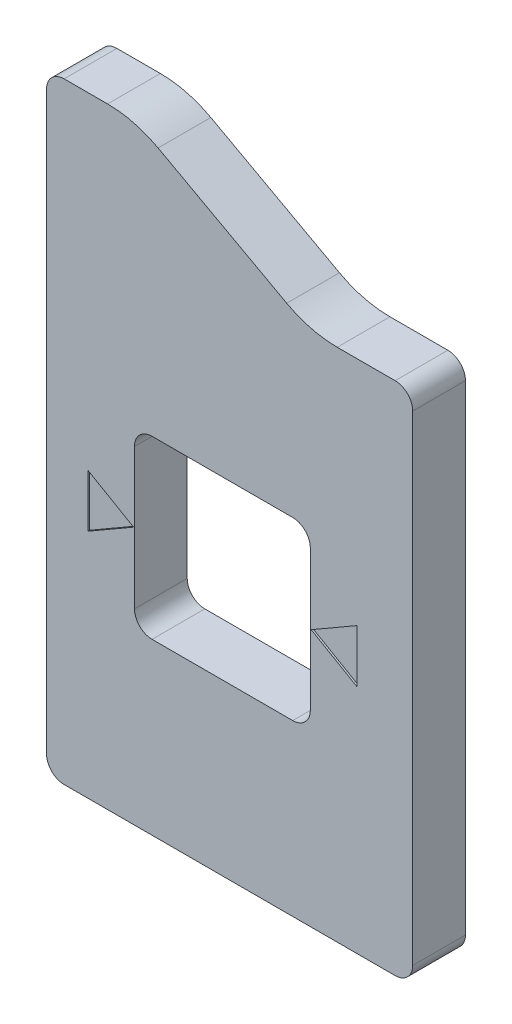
SolidWorks part; units mm, degrees
ref_plane "Plan de face" through (0, 0, 0) normal (0, 0, 1) x (1, 0, 0)
ref_plane "Plan de dessus" through (0, 0, 0) normal (0, 1, 0) x (1, 0, 0)
ref_plane "Plan de droite" through (0, 0, 0) normal (1, 0, 0) x (0, 0, -1)
sketch "Esquisse1" plane through (0, 0, 3) normal (0, 0, 1) x (1, 0, 0)
  line L0 (15.8224, -41.6651) -> (15.8224, -14.3635) construction
  line L1 (14.8224, -13.3635) -> (10, -13.3635) construction
  line L4 (0, -7.9099) -> (-4, -7.9099) construction
  line L5 (-5, -8.9099) -> (-5, -41.6651) construction
  line L8 (15.8224, -41.6651) -> (15.8224, -14.3635)
  line L9 (14.8224, -13.3635) -> (11.5297, -13.3635)
  line L12 (-1.5297, -7.9099) -> (-4, -7.9099)
  line L13 (-5, -8.9099) -> (-5, -41.6651)
  line L16 (-4, -42.6651) -> (14.8224, -42.6651)
  line L17 (1.343, -8.6423) -> (8.657, -12.6311)
  line L18 (1, -23.0143) -> (9, -23.0143)
  line L19 (0, -24.0143) -> (0, -32.0143)
  line L20 (1, -33.0143) -> (9, -33.0143)
  line L21 (10, -24.0143) -> (10, -32.0143)
  line L22 (0, -7.9099) -> (0, -28.0143) construction
  line L23 (10, -42.6651) -> (10, -13.3635) construction
  line L24 (15.8224, -28.0143) -> (-5, -28.0143) construction
  arc A0 (15.8224, -14.3635) -> (14.8224, -13.3635) centre (14.8224, -14.3635) ccw construction
  arc A1 (14.8224, -42.6651) -> (15.8224, -41.6651) centre (14.8224, -41.6651) ccw construction
  arc A2 (-4, -7.9099) -> (-5, -8.9099) centre (-4, -8.9099) ccw construction
  arc A3 (-5, -41.6651) -> (-4, -42.6651) centre (-4, -41.6651) ccw construction
  arc A4 (15.8224, -14.3635) -> (14.8224, -13.3635) centre (14.8224, -14.3635) ccw
  arc A5 (14.8224, -42.6651) -> (15.8224, -41.6651) centre (14.8224, -41.6651) ccw
  arc A6 (-4, -7.9099) -> (-5, -8.9099) centre (-4, -8.9099) ccw
  arc A7 (-5, -41.6651) -> (-4, -42.6651) centre (-4, -41.6651) ccw
  arc A8 (11.5297, -13.3635) -> (8.657, -12.6311) centre (11.5297, -7.3635) cw
  arc A9 (-1.5297, -7.9099) -> (1.343, -8.6423) centre (-1.5297, -13.9099) cw
  arc A10 (0, -32.0143) -> (1, -33.0143) centre (1, -32.0143) ccw
  arc A11 (9, -33.0143) -> (10, -32.0143) centre (9, -32.0143) ccw
  arc A12 (9, -23.0143) -> (10, -24.0143) centre (9, -24.0143) cw
  arc A13 (1, -23.0143) -> (0, -24.0143) centre (1, -24.0143) ccw
  point P24 (0, -28.0143)
  point P37 (10, -23.0143)
  point P40 (0, -23.0143)
  dimension "D1" = 6
  dimension "D3" = 1
  dimension "D2" = 10
extrude "Boss.-Extru.1" add sketch "Esquisse1" along normal blind 3
sketch "Esquisse2" plane through (0, 0, 6) normal (0, 0, 1) x (1, 0, 0)
  line L1 (-2.6481, -26.5143) -> (-2.6481, -29.5143)
  line L4 (-0.05, -28.0143) -> (10.05, -28.0143) construction
  line L5 (-0.05, -28.0143) -> (-2.6481, -26.5143)
  line L6 (10.05, -28.0143) -> (5, -23.0143) construction
  line L7 (9, -23.0143) -> (1, -23.0143) construction
  line L8 (5, -23.0143) -> (5, -33.0143) construction
  line L9 (1, -33.0143) -> (9, -33.0143) construction
  line L10 (10.05, -28.0143) -> (12.6481, -26.5143)
  line L11 (12.6481, -26.5143) -> (12.6481, -29.5143)
  line L12 (12.6481, -29.5143) -> (10.05, -28.0143)
  line L13 (10, -32.0143) -> (10, -24.0143) construction
  line L14 (-2.6481, -29.5143) -> (-0.05, -28.0143)
  point P1 (0, 0)
  point P2 (0, -28.0143)
  point P3 (0, 0)
  point P5 (10.1925, -28.0152)
  point P16 (-2.8263, -29.6461)
  point P17 (0, 0)
  point P18 (0, 0)
  point P19 (0, 0)
  point P20 (12.6813, -26.5143)
  dimension "D1" = 0.05
  dimension "D2" = 3
extrude "Enlèv. mat.-Extru.2" cut sketch "Esquisse2" against normal blind 0.1
